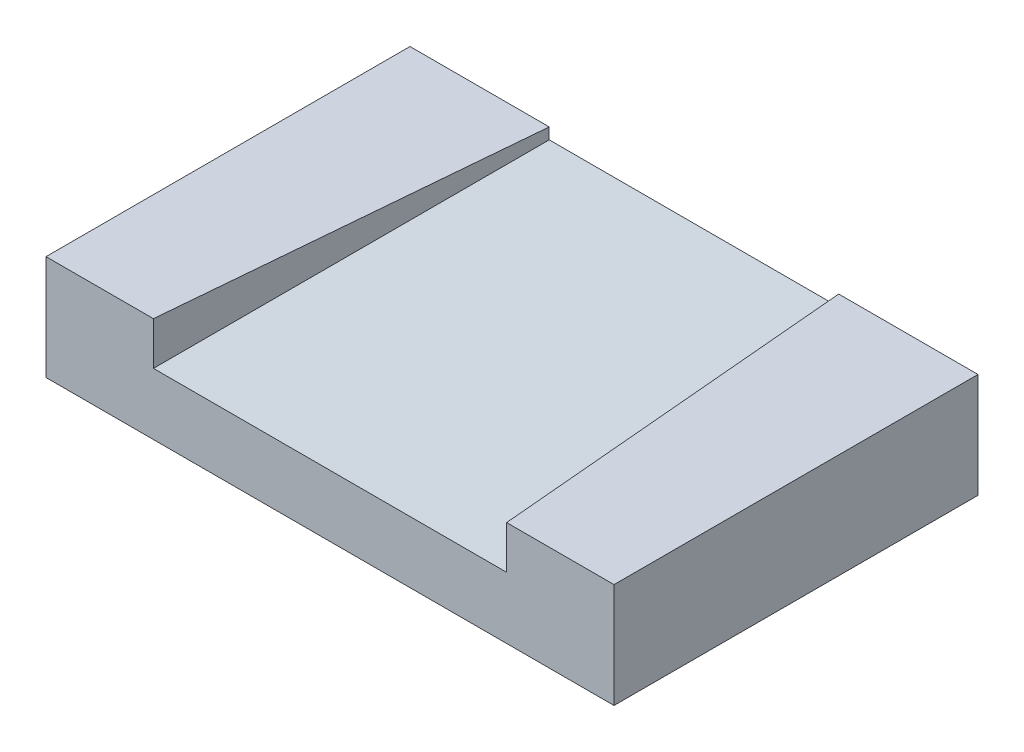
SolidWorks part; units mm, degrees
ref_plane "Front Plane" through (0, 0, 0) normal (0, 0, 1) x (1, 0, 0)
ref_plane "Top Plane" through (0, 0, 0) normal (0, 1, 0) x (1, 0, 0)
ref_plane "Right Plane" through (0, 0, 0) normal (1, 0, 0) x (0, 0, -1)
sketch "Sketch1" plane through (0, 0, 0) normal (0, 1, 0) x (1, 0, 0)
  line L0 (86.7956, -55.6147) -> (-86.7956, 55.6147) construction
  line L1 (-86.7956, 55.6147) -> (86.7956, 55.6147)
  line L2 (-86.7956, 55.6147) -> (-86.7956, -55.6147)
  line L3 (-86.7956, -55.6147) -> (86.7956, -55.6147)
  line L4 (86.7956, 55.6147) -> (86.7956, -55.6147)
extrude "Extrude1" add sketch "Sketch1" along normal blind 32
sketch "Sketch2" plane through (0, 0, 55.6147) normal (0, 0, 1) x (1, 0, 0)
  line L1 (-53.9638, 43.9071) -> (53.9638, 43.9071)
  line L2 (-53.9638, 43.9071) -> (-53.9638, 18.8425)
  line L3 (-53.9638, 18.8425) -> (53.9638, 18.8425)
  line L4 (53.9638, 43.9071) -> (53.9638, 18.8425)
  line L5 (0, 0) -> (0, 18.8425) construction
extrude "Cut-Extrude1" cut sketch "Sketch2" against normal through all draft 5
